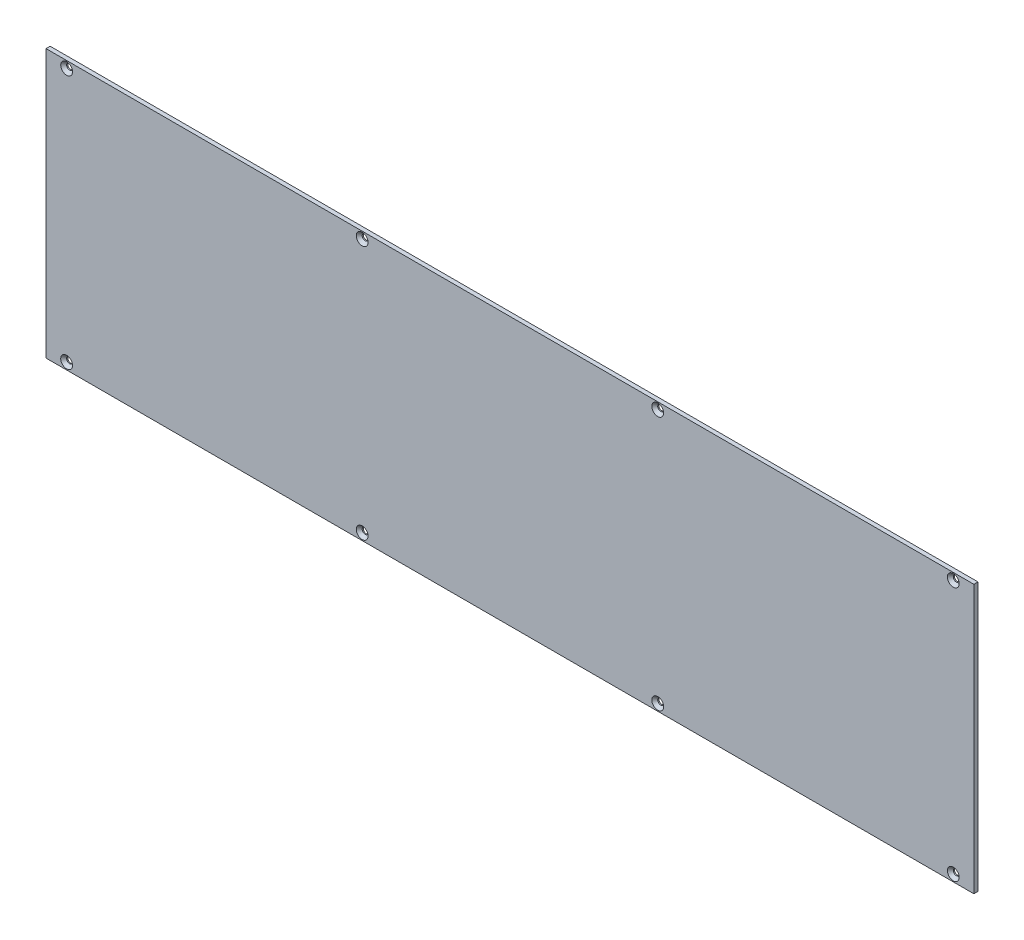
SolidWorks part; units mm, degrees
ref_plane "Спереди" through (0, 0, 0) normal (0, 0, 1) x (1, 0, 0)
ref_plane "Сверху" through (0, 0, 0) normal (0, 1, 0) x (1, 0, 0)
ref_plane "Справа" through (0, 0, 0) normal (1, 0, 0) x (0, 0, -1)
sketch "Эскиз1" plane through (0, 0, 0) normal (0, 0, 1) x (1, 0, 0)
  line L1 (0, 0) -> (675, 0)
  line L2 (0, 0) -> (0, 195)
  line L3 (0, 195) -> (675, 195)
  line L4 (675, 0) -> (675, 195)
  dimension "D1" = 195
  dimension "D2" = 675
extrude "Бобышка-Вытянуть1" add sketch "Эскиз1" along normal blind 3
sketch "Эскиз2" plane through (0, 0, 3) normal (0, 0, 1) x (1, 0, 0)
  line L0 (337.5, 267.0104) -> (337.5, -101.9444) construction
  line L1 (-48.1622, 97.5) -> (749.6155, 97.5) construction
  line L2 (675, 195) -> (0, 195) construction
  line L3 (0, 195) -> (0, 0) construction
  circle A0 centre (15, 190) radius 4.3
  circle A1 centre (230, 190) radius 4.3
  circle A2 centre (445, 190) radius 4.3
  circle A3 centre (660, 190) radius 4.3
  circle A4 centre (15, 5) radius 4.3
  circle A5 centre (230, 5) radius 4.3
  circle A7 centre (445, 5) radius 4.3
  circle A8 centre (660, 5) radius 4.3
  point P6 (337.5, 195)
  point P9 (0, 97.5)
  dimension "D1" = 8.6
  dimension "D2" = 8.6
  dimension "D3" = 8.6
  dimension "D4" = 8.6
  dimension "D5" = 8.6
  dimension "D6" = 8.6
  dimension "D7" = 8.6
  dimension "D8" = 8.6
  dimension "D9" = 15
  dimension "D10" = 215
  dimension "D11" = 185
  dimension "D12" = 185
extrude "Вырез-Вытянуть1" cut sketch "Эскиз2" against normal blind 2.15
draft "Уклон1" type of draft neutral plane draft angle 45 faces to draft 8 parameters "D1"=45
sketch "Эскиз3" plane through (0, 0, 0.85) normal (0, 0, 1) x (1, 0, 0)
  circle A0 centre (15, 190) radius 2.15
  dimension "D1" = 4.3
extrude "Вырез-Вытянуть2" cut sketch "Эскиз3" against normal through all
sketch "Эскиз4" plane through (0, 0, 0.85) normal (0, 0, 1) x (1, 0, 0)
  circle A0 centre (230, 190) radius 2.15
  dimension "D1" = 4.3
extrude "Вырез-Вытянуть3" cut sketch "Эскиз4" against normal through all
sketch "Эскиз6" plane through (0, 0, 0.85) normal (0, 0, 1) x (1, 0, 0)
  circle A0 centre (445, 190) radius 2.15
  circle A1 centre (445, 190) radius 2.15 construction
  dimension "D1" = 4.3
extrude "Вырез-Вытянуть4" cut sketch "Эскиз6" against normal through all
sketch "Эскиз7" plane through (0, 0, 0.85) normal (0, 0, 1) x (1, 0, 0)
  circle A0 centre (660, 190) radius 2.15
  circle A1 centre (660, 190) radius 2.15 construction
  dimension "D1" = 4.3
extrude "Вырез-Вытянуть5" cut sketch "Эскиз7" against normal through all
sketch "Эскиз8" plane through (0, 0, 0.85) normal (0, 0, 1) x (1, 0, 0)
  circle A0 centre (660, 5) radius 2.15
  dimension "D1" = 4.3
extrude "Вырез-Вытянуть6" cut sketch "Эскиз8" against normal through all
sketch "Эскиз9" plane through (0, 0, 0.85) normal (0, 0, 1) x (1, 0, 0)
  circle A0 centre (445, 5) radius 2.15
  dimension "D1" = 4.3
extrude "Вырез-Вытянуть7" cut sketch "Эскиз9" against normal through all
sketch "Эскиз10" plane through (0, 0, 0.85) normal (0, 0, 1) x (1, 0, 0)
  circle A0 centre (230, 5) radius 2.15
  circle A1 centre (230, 5) radius 2.15 construction
  dimension "D1" = 4.3
extrude "Вырез-Вытянуть8" cut sketch "Эскиз10" against normal through all
sketch "Эскиз11" plane through (0, 0, 0.85) normal (0, 0, 1) x (1, 0, 0)
  circle A0 centre (15, 5) radius 2.15
  circle A1 centre (15, 5) radius 2.15 construction
  dimension "D1" = 4.3
extrude "Вырез-Вытянуть9" cut sketch "Эскиз11" against normal through all and the other way through all
